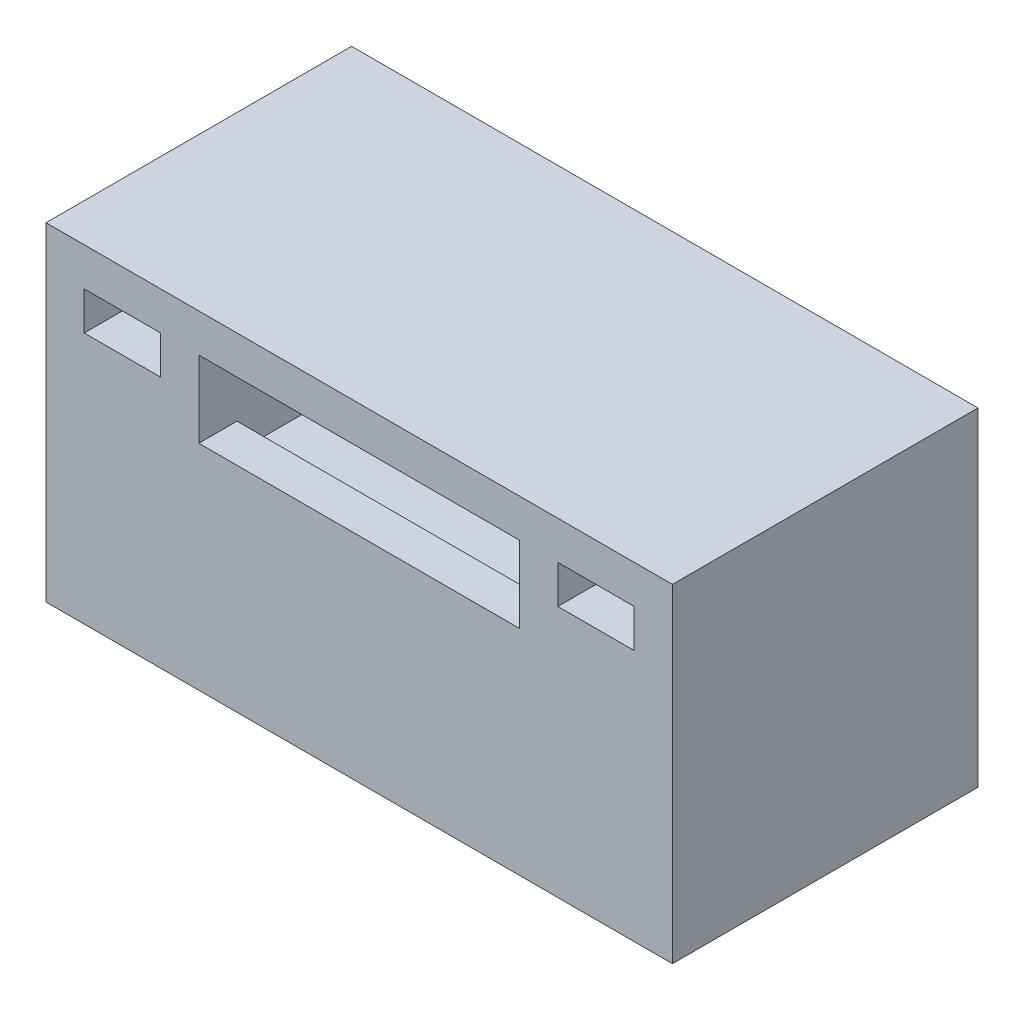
SolidWorks part; units mm, degrees
ref_plane "前视基准面" through (0, 0, 0) normal (0, 0, 1) x (1, 0, 0)
ref_plane "上视基准面" through (0, 0, 0) normal (0, 1, 0) x (1, 0, 0)
ref_plane "右视基准面" through (0, 0, 0) normal (1, 0, 0) x (0, 0, -1)
sketch "草图1" plane through (0, 0, 0) normal (0, 0, 1) x (1, 0, 0)
  line L0 (0, 4.3394) -> (0, -4.6386) construction
  line L1 (-4.1, 2.15) -> (4.1, 2.15)
  line L2 (-4.1, 2.15) -> (-4.1, -2.15)
  line L3 (-4.1, -2.15) -> (4.1, -2.15)
  line L4 (4.1, 2.15) -> (4.1, -2.15)
  line L5 (-4.1, 2.15) -> (4.1, -2.15) construction
  line L6 (-4.1, -2.15) -> (4.1, 2.15) construction
  line L7 (2.6, -0.1994) -> (-2.6, -0.1994)
  line L8 (-3.6, 1.65) -> (-2.6, 1.65)
  line L9 (-3.6, 1.65) -> (-3.6, 1.15)
  line L10 (-3.6, 1.15) -> (-2.6, 1.15)
  line L11 (-2.6, 1.65) -> (-2.6, 1.15)
  line L12 (2.1, 1.65) -> (-2.1, 1.65)
  line L13 (3.6, 0.65) -> (3.6, -1.65)
  line L14 (2.1, 0.3006) -> (-2.1, 0.3006)
  line L15 (-2.1, 1.65) -> (-2.1, 0.3006)
  line L16 (-2.6, -0.1994) -> (-2.6, 0.65)
  line L17 (-2.6, 0.65) -> (-3.6, 0.65)
  line L18 (-3.6, 0.65) -> (-3.6, -1.65)
  line L19 (-3.6, -1.65) -> (3.6, -1.65)
  line L20 (2.6, 0.65) -> (3.6, 0.65)
  line L21 (2.6, -0.1994) -> (2.6, 0.65)
  line L22 (2.1, 1.65) -> (2.1, 0.3006)
  line L23 (2.6, 1.65) -> (2.6, 1.15)
  line L24 (3.6, 1.15) -> (2.6, 1.15)
  line L25 (3.6, 1.65) -> (3.6, 1.15)
  line L26 (3.6, 1.65) -> (2.6, 1.65)
  point P0 (0, 0)
  point P12 (-3.6, 1.4)
  point P15 (0, 1.65)
  point P22 (0, 0.3006)
  point P25 (0, -1.65)
  point P30 (0, 0.3006)
  point P34 (0, -0.1994)
  dimension "D1" = 4.3
  dimension "D2" = 0.5
  dimension "D3" = 1
  dimension "D4" = 0.5
  dimension "D5" = 0.5
  dimension "D6" = 0.5
  dimension "D7" = 0.5
  dimension "D8" = 0.5
  dimension "D9" = 0.5
  dimension "D10" = 0.5
  dimension "D11" = 0.3006
  dimension "D12" = 1.3494
  dimension "D13" = 8.2
extrude "凸台-拉伸1" add sketch "草图1" along normal blind 4
sketch "草图2" plane through (0, 0, 4) normal (0, 0, 1) x (1, 0, 0)
  line L1 (-3.6, 0.65) -> (3.6, 0.65)
  line L2 (-3.6, 0.65) -> (-3.6, -1.65)
  line L3 (-3.6, -1.65) -> (3.6, -1.65)
  line L4 (3.6, 0.65) -> (3.6, -1.65)
extrude "凸台-拉伸2" add sketch "草图2" against normal blind 0.5
